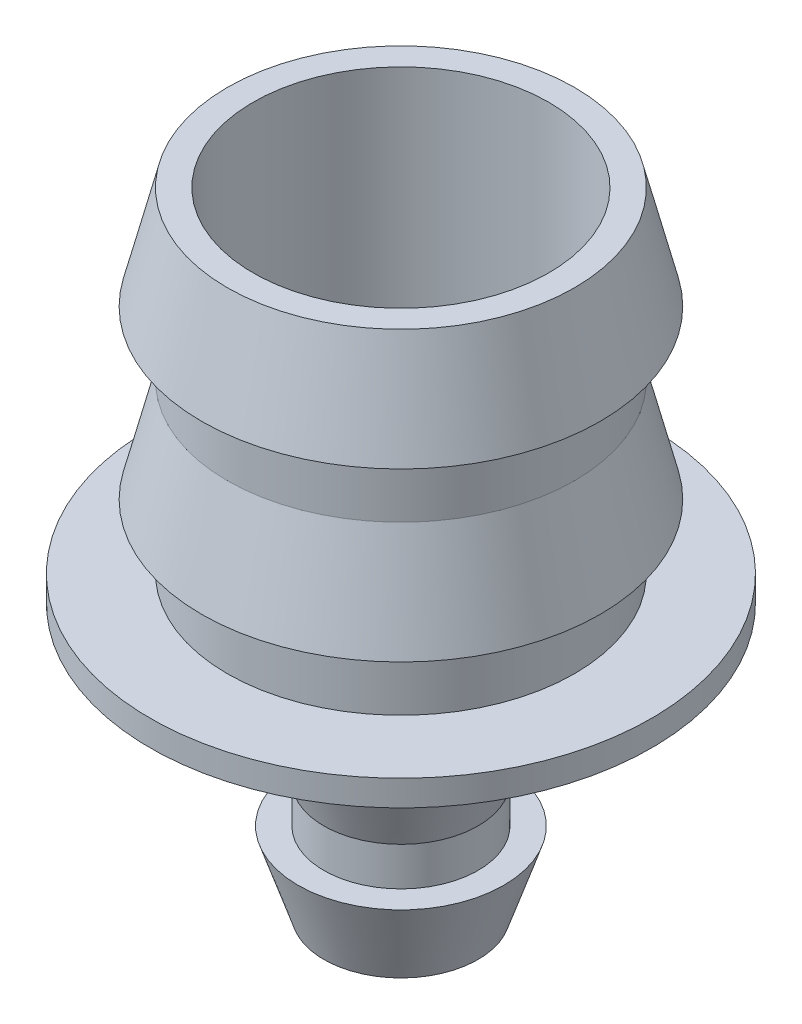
SolidWorks part; units mm, degrees
ref_plane "Front Plane" through (0, 0, 0) normal (0, 0, 1) x (1, 0, 0)
ref_plane "Top Plane" through (0, 0, 0) normal (0, 1, 0) x (1, 0, 0)
ref_plane "Right Plane" through (0, 0, 0) normal (1, 0, 0) x (0, 0, -1)
sketch "Sketch1" plane through (0, 0, 0) normal (0, 0, 1) x (1, 0, 0)
  line L0 (0, 0) -> (0, 10.5) construction
  line L1 (-6.75, 10.5) -> (-7.75, 6.5)
  line L2 (-7.75, 6.5) -> (-6.75, 6.5)
  line L3 (-6.75, 6.5) -> (-6.75, 4)
  line L4 (-6.75, 4) -> (-7.75, 0)
  line L5 (-7.75, 0) -> (-6.75, 0)
  line L6 (-6.75, 0) -> (-6.75, -2.5)
  line L7 (-6.75, 10.5) -> (-5.75, 10.5)
  line L8 (-5.75, 10.5) -> (-5.75, -2.5)
  line L9 (-6.75, -2.5) -> (-9.75, -2.5)
  line L10 (-9.75, -2.5) -> (-9.75, -3.5)
  line L11 (-9.75, -3.5) -> (-6.75, -3.5)
  line L12 (-3, 11) -> (-3, -6.5) construction
  line L13 (-2, -14) -> (-2, -3.5)
  line L14 (-5.75, -2.5) -> (-2, -3.5)
  line L15 (-6.75, -3.5) -> (-3, -4.5)
  line L16 (-3, -4.5) -> (-3, -6.5)
  line L17 (-3, -6.5) -> (-4, -6.5)
  line L18 (-4, -6.5) -> (-3, -9.5)
  line L19 (-3, -9.5) -> (-3, -11)
  line L20 (-3, -11) -> (-4, -11)
  line L21 (-4, -11) -> (-3, -14)
  line L22 (-3, -14) -> (-2, -14)
  point P16 (-5.3307, -9.5)
  point P26 (0, 0)
  dimension "D1" = 5.75
  dimension "D2" = 6.75
  dimension "D3" = 7.75
  dimension "D4" = 1
  dimension "D5" = 2.5
  dimension "D6" = 4
  dimension "D7" = 4
  dimension "D8" = 1
  dimension "D9" = 3
  dimension "D10" = 2.5
  dimension "D11" = 3
  dimension "D12" = 1
  dimension "D13" = 2
  dimension "D14" = 3
  dimension "D15" = 3
  dimension "D16" = 1.5
revolve "Revolve1" add sketch "Sketch1" angle 360 about L0
